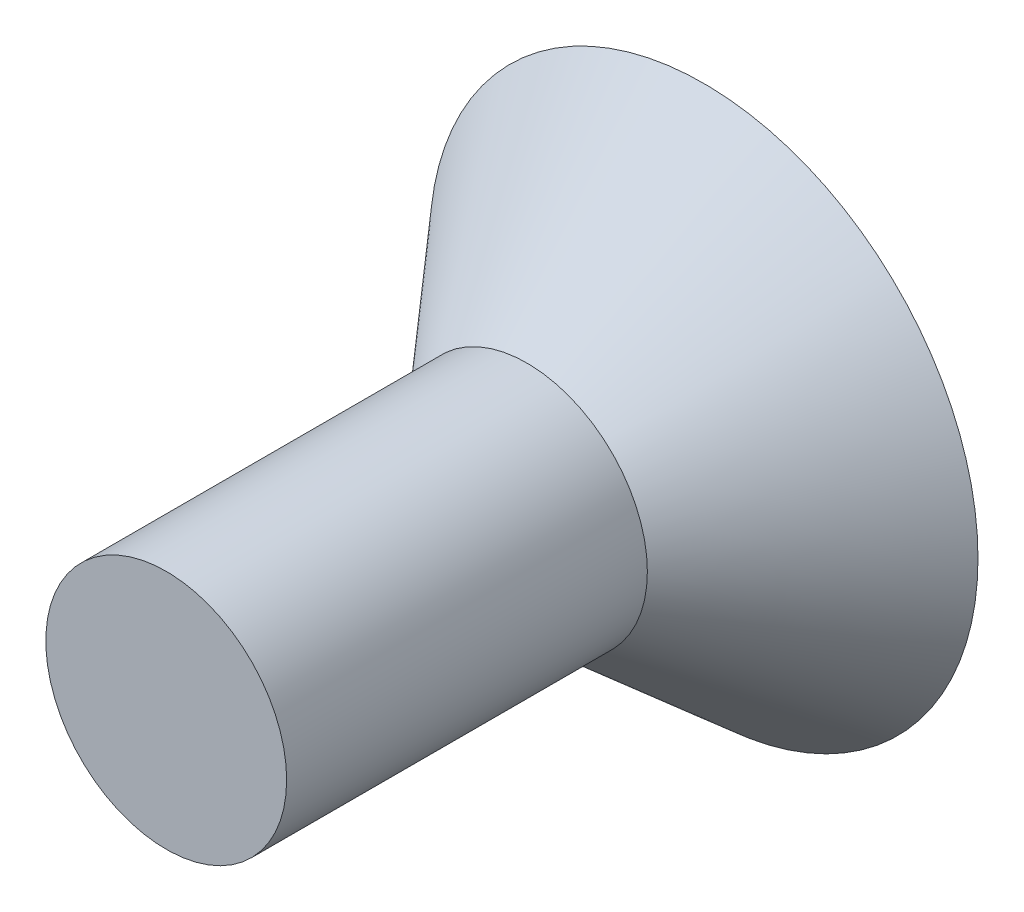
SolidWorks part; units mm, degrees
ref_plane "Front Plane" through (0, 0, 0) normal (0, 0, 1) x (1, 0, 0)
ref_plane "Top Plane" through (0, 0, 0) normal (0, 1, 0) x (1, 0, 0)
ref_plane "Right Plane" through (0, 0, 0) normal (1, 0, 0) x (0, 0, -1)
sketch "Sketch6" plane through (0, 0, 0) normal (1, 0, 0) x (0, 0, -1)
  line L0 (-6.35, 0) -> (22.525, 0) construction
  line L1 (3.4925, 0) -> (-3.4925, 0) construction
  line L2 (-6.35, 0) -> (-6.35, -1.4224)
  line L3 (-6.35, -1.4224) -> (-2.0892, -1.4224)
  line L6 (-2.0892, -1.4224) -> (0, -3.2385)
  line L7 (0, -3.2385) -> (0, 0)
  line L8 (0, 0) -> (-6.35, 0)
  dimension "D1" = 41
  dimension "L" = 6.35
  dimension "A" = 6.477
  dimension "D" = 2.8448
revolve "Revolve1" add sketch "Sketch6" angle 360 about L0
sketch "Sketch7" plane through (0, 0, 0) normal (0, 0, -1) x (-1, 0, 0)
  line L2 (-0.8001, 0.4619) -> (-0.8001, -0.4619)
  line L4 (-0.8001, -0.4619) -> (0, -0.9239)
  line L5 (0, -0.9239) -> (0.8001, -0.4619)
  line L6 (0.8001, -0.4619) -> (0.8001, 0.4619)
  line L7 (0.8001, 0.4619) -> (0, 0.9239)
  line L8 (0, 0.9239) -> (-0.8001, 0.4619)
  circle A0 centre (0, 0) radius 0.8001 construction
  dimension "J" = 1.6002
extrude "HEX" cut sketch "Sketch7" against normal blind 1.778
